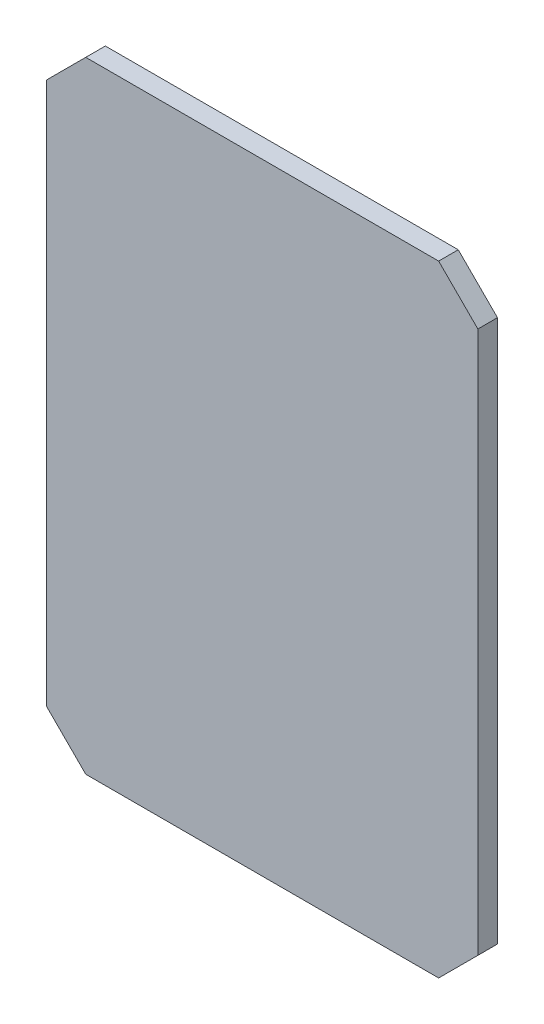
SolidWorks part; units mm, degrees
ref_plane "Plan de face" through (0, 0, 0) normal (0, 0, 1) x (1, 0, 0)
ref_plane "Plan de dessus" through (0, 0, 0) normal (0, 1, 0) x (1, 0, 0)
ref_plane "Plan de droite" through (0, 0, 0) normal (1, 0, 0) x (0, 0, -1)
sketch "Esquisse1" plane through (0, 0, 0) normal (0, 0, 1) x (1, 0, 0)
  line L1 (-33, 47.5) -> (33, 47.5)
  line L2 (-33, 47.5) -> (-33, -47.5)
  line L3 (-33, -47.5) -> (33, -47.5)
  line L4 (33, 47.5) -> (33, -47.5)
  point P4 (33, 0)
  point P6 (0, 47.5)
  dimension "D1" = 66
  dimension "D2" = 95
extrude "Boss.-Extru.1" add sketch "Esquisse1" along normal blind 3
chamfer "Chanfrein1" distance 6 angle 45 4 edges at (-33, -47.5, 1.5) (-33, 47.5, 1.5) (33, 47.5, 1.5) (33, -47.5, 1.5)
